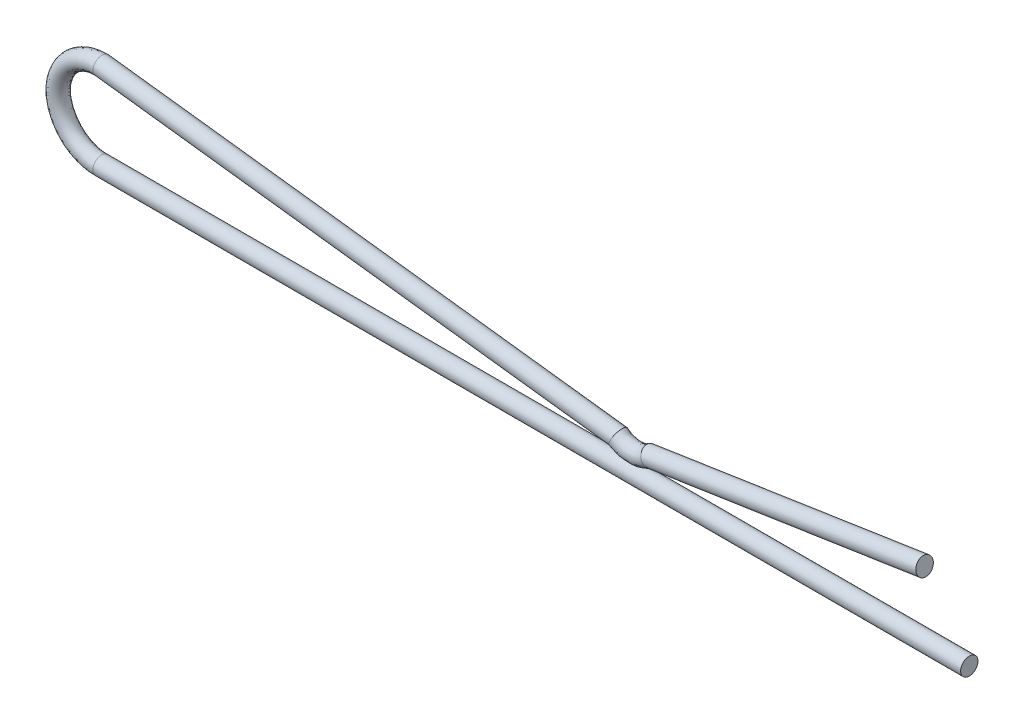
SolidWorks part; units mm, degrees
ref_plane "Front Plane" through (0, 0, 0) normal (0, 0, 1) x (1, 0, 0)
ref_plane "Top Plane" through (0, 0, 0) normal (0, 1, 0) x (1, 0, 0)
ref_plane "Right Plane" through (0, 0, 0) normal (1, 0, 0) x (0, 0, -1)
sketch "Sketch1" plane through (0, 0, 0) normal (0, 0, 1) x (1, 0, 0)
  line L0 (-17.2507, -18.6608) -> (-27.2507, -18.6608)
  line L1 (-27.2507, -17.6608) -> (-21.2953, -18.391)
  line L2 (-20.9298, -18.4031) -> (-17.7663, -17.9215)
  arc A0 (-27.2507, -18.6608) -> (-27.2507, -17.6608) centre (-27.2507, -18.1608) cw
  arc A1 (-21.2953, -18.391) -> (-20.9298, -18.4031) centre (-21.1047, -18.1593) ccw
  dimension "D1" = 10
ref_plane "Plane1" through (-17.2507, -18.6608, 0) normal (-1, 0, 0) x (0, 0, 1)
sketch "Sketch2" plane through (-17.2507, -18.6608, 0) normal (-1, 0, 0) x (0, 0, 1)
  circle A0 centre (0, 0) radius 0.1
sweep "Sweep1" add profiles "Sketch2" path "Sketch1"
